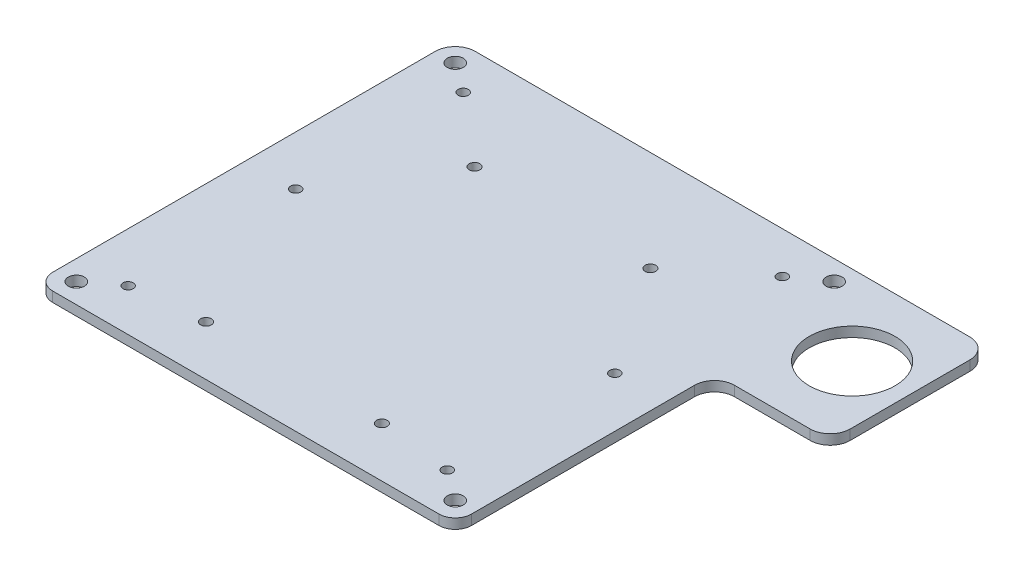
SolidWorks part; units mm, degrees
ref_plane "Front Plane" through (0, 0, 0) normal (0, 0, 1) x (1, 0, 0)
ref_plane "Top Plane" through (0, 0, 0) normal (0, 1, 0) x (1, 0, 0)
ref_plane "Right Plane" through (0, 0, 0) normal (1, 0, 0) x (0, 0, -1)
sketch "Sketch1" plane through (0, 0, 0) normal (0, 1, 0) x (1, 0, 0)
  line L1 (-60.325, 66.675) -> (97.155, 66.675)
  line L2 (-66.675, 60.325) -> (-66.675, -61.4938)
  line L3 (-61.4938, -66.675) -> (61.4938, -66.675)
  line L4 (66.675, 9.525) -> (66.675, -61.4938)
  line L11 (103.505, 60.325) -> (103.505, 22.225)
  line L12 (97.155, 15.875) -> (73.025, 15.875)
  arc A2 (61.4938, -66.675) -> (66.675, -61.4938) centre (61.4938, -61.4938) ccw
  arc A3 (-66.675, -61.4938) -> (-61.4938, -66.675) centre (-61.4938, -61.4938) ccw
  arc A4 (73.025, 15.875) -> (66.675, 9.525) centre (73.025, 9.525) ccw
  arc A5 (103.505, 22.225) -> (97.155, 15.875) centre (97.155, 22.225) cw
  arc A6 (97.155, 66.675) -> (103.505, 60.325) centre (97.155, 60.325) cw
  arc A7 (-60.325, 66.675) -> (-66.675, 60.325) centre (-60.325, 60.325) ccw
  point P0 (0, 0)
  dimension "D5" = 66.675
  dimension "D6" = 6.35
  dimension "D1" = 133.35
  dimension "D2" = 133.35
  dimension "D3" = 50.8
  dimension "D4" = 170.18
extrude "Boss-Extrude1" add sketch "Sketch1" along normal blind 3.175
hole_wizard "M3 Clearance Hole1" positions "Sketch2" profile "Sketch3" hole size "M3" standard "ANSI Metric"
sketch "Sketch2" plane through (0, 0, 0) normal (0, -1, 0) x (-1, 0, 0)
  point P0 (28.5897, 34.7348)
  point P3 (-27.4103, 34.7348)
  point P6 (28.5897, -50.7652)
  point P9 (-27.4103, -50.7652)
sketch "Sketch3" plane through (-28.5897, 0, -34.7348) normal (1, 0, 0) x (0, 0, -1)
  line L0 (0, 0) -> (0, 3.175)
  line L1 (0, 3.175) -> (1.7, 3.175)
  line L2 (1.7, 3.175) -> (1.7, 0)
  line L5 (1.7, 0) -> (0, 0)
  line L11 (0, -6.35) -> (0, 107.95) construction
  dimension "Thru Hole Dia." = 3.4
  dimension "Thru Hole Depth" = 3.175
hole_wizard "#10 Clearance Hole1" positions "Sketch4" profile "Sketch5" hole size "#10" standard "ANSI Inch"
sketch "Sketch4" plane through (0, 3.175, 0) normal (0, 1, 0) x (1, 0, 0)
  line L0 (-60.325, 60.325) -> (60.325, 60.325) construction
  line L1 (60.325, 60.325) -> (60.325, -60.325) construction
  line L2 (60.325, -60.325) -> (-60.325, -60.325) construction
  line L3 (-60.325, -60.325) -> (-60.325, 60.325) construction
  line L5 (-66.675, 60.325) -> (-66.675, -61.4938) construction
  line L7 (97.155, 66.675) -> (-60.325, 66.675) construction
  line L8 (66.675, -61.4938) -> (66.675, 9.525) construction
  line L9 (-61.4938, -66.675) -> (61.4938, -66.675) construction
  point P0 (-60.325, 60.325)
  point P2 (60.325, 60.325)
  point P4 (60.325, -60.325)
  point P6 (-60.325, -60.325)
  dimension "D1" = 6.35
  dimension "D2" = 6.35
  dimension "D3" = 6.35
  dimension "D4" = 6.35
sketch "Sketch5" plane through (-60.325, 3.175, -60.325) normal (1, 0, 0) x (0, 0, 1)
  line L0 (0, 0) -> (0, 3.175)
  line L1 (0, 3.175) -> (2.5527, 3.175)
  line L2 (2.5527, 3.175) -> (2.5527, 0)
  line L5 (2.5527, 0) -> (0, 0)
  line L11 (0, -6.35) -> (0, 107.95) construction
  dimension "Thru Hole Dia." = 5.1054
  dimension "Thru Hole Depth" = 3.175
hole_wizard "#4 Clearance Hole1" positions "Sketch6" profile "Sketch7" hole size "#4" standard "ANSI Inch"
sketch "Sketch6" plane through (0, 0, 0) normal (0, -1, 0) x (-1, 0, 0)
  point P0 (50.927, -53.213)
  point P3 (-50.673, -53.213)
  point P6 (-50.673, 53.467)
  point P9 (50.927, 53.467)
  point P12 (50.927, 0.127)
  point P15 (-50.673, 0.127)
sketch "Sketch7" plane through (-50.927, 0, 53.213) normal (1, 0, 0) x (0, 0, -1)
  line L0 (0, 0) -> (0, 3.175)
  line L1 (0, 3.175) -> (1.6319, 3.175)
  line L2 (1.6319, 3.175) -> (1.6319, 0)
  line L5 (1.6319, 0) -> (0, 0)
  line L11 (0, -6.35) -> (0, 107.95) construction
  dimension "Thru Hole Dia." = 3.2639
  dimension "Thru Hole Depth" = 3.175
sketch "Sketch8" plane through (0, 3.175, 0) normal (0, 1, 0) x (1, 0, 0)
  line L0 (103.505, 41.275) -> (49.3887, 41.275) construction
  line L1 (103.505, 22.225) -> (103.505, 60.325) construction
  line L2 (85.09, 15.875) -> (85.09, 66.675) construction
  line L3 (73.025, 15.875) -> (97.155, 15.875) construction
  line L4 (97.155, 66.675) -> (-60.325, 66.675) construction
  circle A0 centre (85.09, 41.275) radius 13.6525
  dimension "D1" = 27.305
extrude "Cut-Extrude1" cut sketch "Sketch8" against normal through all
